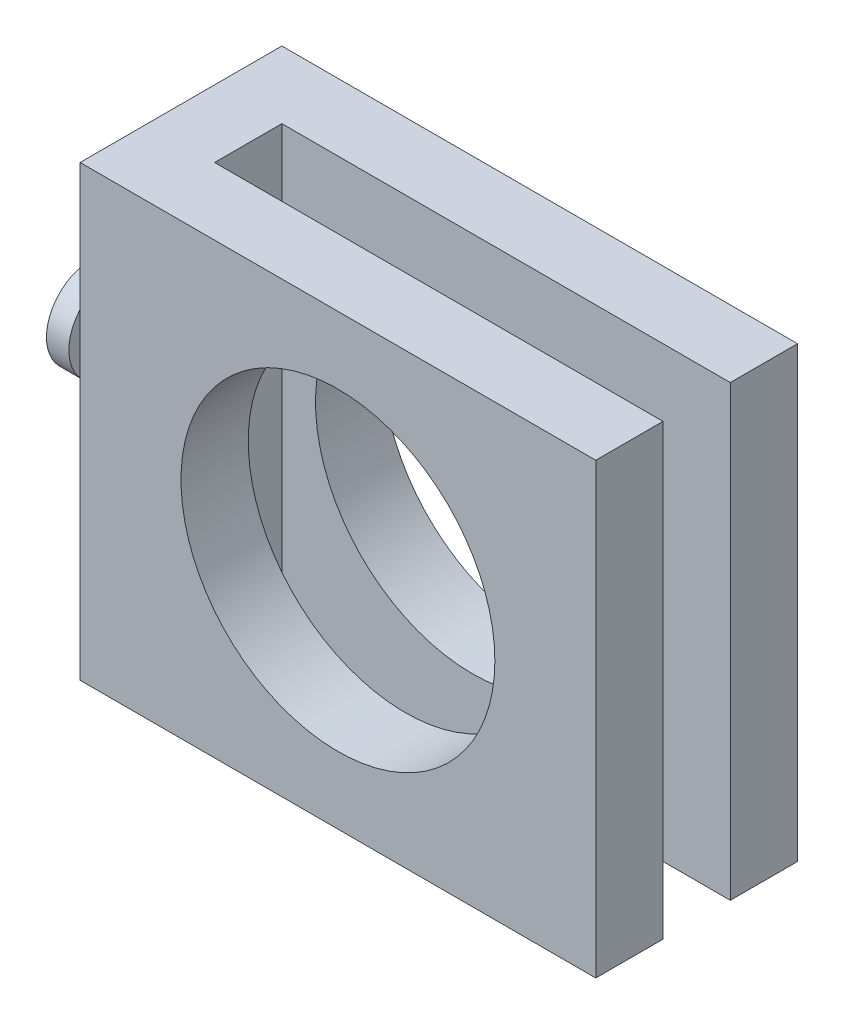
SolidWorks part; units mm, degrees
ref_plane "Front Plane" through (0, 0, 0) normal (0, 0, 1) x (1, 0, 0)
ref_plane "Top Plane" through (0, 0, 0) normal (0, 1, 0) x (1, 0, 0)
ref_plane "Right Plane" through (0, 0, 0) normal (1, 0, 0) x (0, 0, -1)
sketch "Sketch1" plane through (0, 0, 0) normal (0, 0, 1) x (1, 0, 0)
  line L1 (10, -10) -> (-10, -10)
  line L2 (10, -10) -> (10, 10)
  line L3 (10, 10) -> (-10, 10)
  line L4 (-10, -10) -> (-10, 10)
  line L5 (10, -10) -> (-10, 10) construction
  line L6 (10, 10) -> (-10, -10) construction
  point P0 (0, 0)
  dimension "D1" = 20
  dimension "D2" = 20
extrude "Boss-Extrude1" add sketch "Sketch1" along normal blind 3
sketch "Sketch2" plane through (10, 0, 0) normal (1, 0, 0) x (0, 0, -1)
  line L0 (0, -10) -> (0, 10) construction
  line L1 (6, 10) -> (3, 10)
  line L2 (6, 10) -> (6, -10)
  line L3 (6, -10) -> (3, -10)
  line L4 (3, 10) -> (3, -10)
  line L5 (6, 10) -> (3, -10) construction
  line L6 (6, -10) -> (3, 10) construction
  point P0 (4.5, 0)
  dimension "D1" = 3
  dimension "D2" = 3
extrude "Boss-Extrude2" add sketch "Sketch2" against normal blind 20 separate body
sketch "Sketch3" plane through (-10, 0, 0) normal (-1, 0, 0) x (0, 0, 1)
  line L1 (-6, 10) -> (3, 10)
  line L2 (-6, 10) -> (-6, -10)
  line L3 (-6, -10) -> (3, -10)
  line L4 (3, 10) -> (3, -10)
extrude "Boss-Extrude3" add sketch "Sketch3" along normal blind 3
sketch "Sketch4" plane through (-13, 0, 0) normal (-1, 0, 0) x (0, 0, 1)
  circle A0 centre (-1.5, 0) radius 1.5
  dimension "D1" = 3
extrude "Boss-Extrude4" add sketch "Sketch4" along normal blind 3
sketch "Sketch5" plane through (-16, 0, 0) normal (-1, 0, 0) x (0, 0, 1)
  circle A0 centre (-1.5, 0) radius 2
  dimension "D1" = 4
extrude "Boss-Extrude5" add sketch "Sketch5" along normal blind 1
sketch "Sketch6" plane through (0, 0, 3) normal (0, 0, 1) x (1, 0, 0)
  circle A0 centre (-1.5, 0) radius 7
  dimension "D1" = 14
extrude "Cut-Extrude1" cut sketch "Sketch6" against normal blind 10
